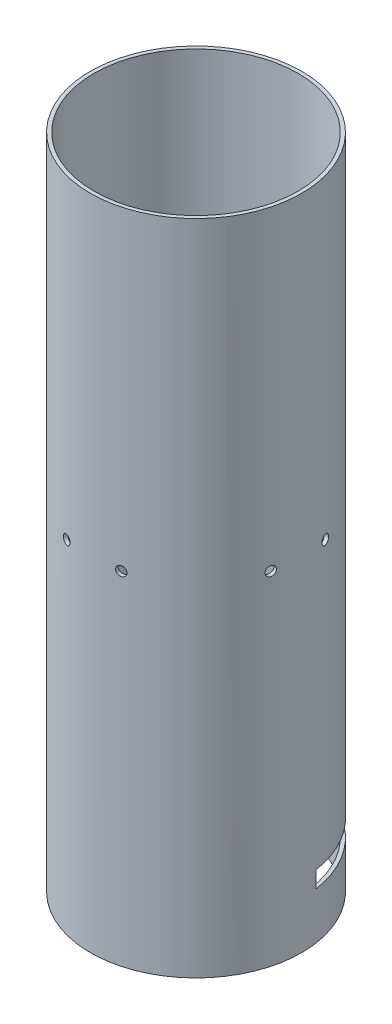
SolidWorks part; units mm, degrees
ref_plane "Front Plane" through (0, 0, 0) normal (0, 0, 1) x (1, 0, 0)
ref_plane "Top Plane" through (0, 0, 0) normal (0, 1, 0) x (1, 0, 0)
ref_plane "Right Plane" through (0, 0, 0) normal (1, 0, 0) x (0, 0, -1)
sketch "Sketch1" plane through (0, 0, 0) normal (0, 1, 0) x (1, 0, 0)
  circle A0 centre (0, 0) radius 44.704
  circle A1 centre (0, 0) radius 43.18
  dimension "D1" = 89.408
  dimension "D2" = 86.36
extrude "Boss-Extrude1" add sketch "Sketch1" along normal blind 304.8
ref_plane "Plane1" through (0, 0, 44.704) normal (0, 0, 1) x (1, 0, 0)
sketch "Sketch3" plane through (0, 0, 44.704) normal (0, 0, 1) x (1, 0, 0)
  line L0 (43.18, 304.8) -> (-43.18, 304.8) construction
  circle A0 centre (0, 203.2) radius 2.3812
  dimension "D1" = 4.7625
  dimension "D2" = 101.6
extrude "Cut-Extrude1" [suppressed] cut sketch "Sketch3" against normal up to surface (1.5897 mm away)
pattern_circular "CirPattern1" [suppressed] count 4 over 360
ref_plane "Plane2" through (-11.5702, 0, 43.1807) normal (-0.2588, 0, 0.9659) x (0, -1, 0)
sketch "Sketch5" plane through (-11.5702, 0, 43.1807) normal (-0.2588, 0, 0.9659) x (0, -1, 0)
  line L0 (-304.8, 44.704) -> (-304.8, -44.704) construction
  circle A0 centre (-171.4256, 0) radius 2
  dimension "D1" = 4
  dimension "D2" = 133.3744
extrude "Cut-Extrude2" cut sketch "Sketch5" against normal up to surface (1.5703 mm away)
mirror "Mirror1" about plane through (0, 0, 0) normal (1, 0, 0) of "Cut-Extrude2"
pattern_circular "CirPattern3" count 4 over 360 about axis through (0, 304.8, 0) along (0, 1, 0) of "Cut-Extrude2", "Mirror1"
sketch "Sketch6" plane through (0, 0, 0) normal (0, -1, 0) x (1, 0, 0)
  circle A0 centre (0, 0) radius 53.668
extrude "Cut-Extrude3" cut sketch "Sketch6" against normal blind 26.615
ref_plane "Plane4" through (0, 0, 0) normal (-0.7071, 0, 0.7071) x (0.7071, 0, 0.7071)
ref_plane "Plane5" through (31.6105, 0, -31.6105) normal (-0.7071, 0, 0.7071) x (0.7071, 0, 0.7071)
sketch "Sketch8" plane through (31.6105, 0, -31.6105) normal (-0.7071, 0, 0.7071) x (0.7071, 0, 0.7071)
  line L0 (-44.704, 26.615) -> (44.704, 26.615) construction
  line L2 (26.67, 53.4755) -> (-26.67, 53.4755)
  line L3 (26.67, 53.4755) -> (26.67, 46.4905)
  line L4 (26.67, 46.4905) -> (-26.67, 46.4905)
  line L5 (-26.67, 53.4755) -> (-26.67, 46.4905)
  point P11 (0, 53.4755)
  point P12 (-26.67, 49.983)
  dimension "D7" = 53.34
  dimension "D8" = 6.985
  dimension "D9" = 23.368
extrude "Cut-Extrude5" cut sketch "Sketch8" along normal up to surface (10.7449 mm away)
